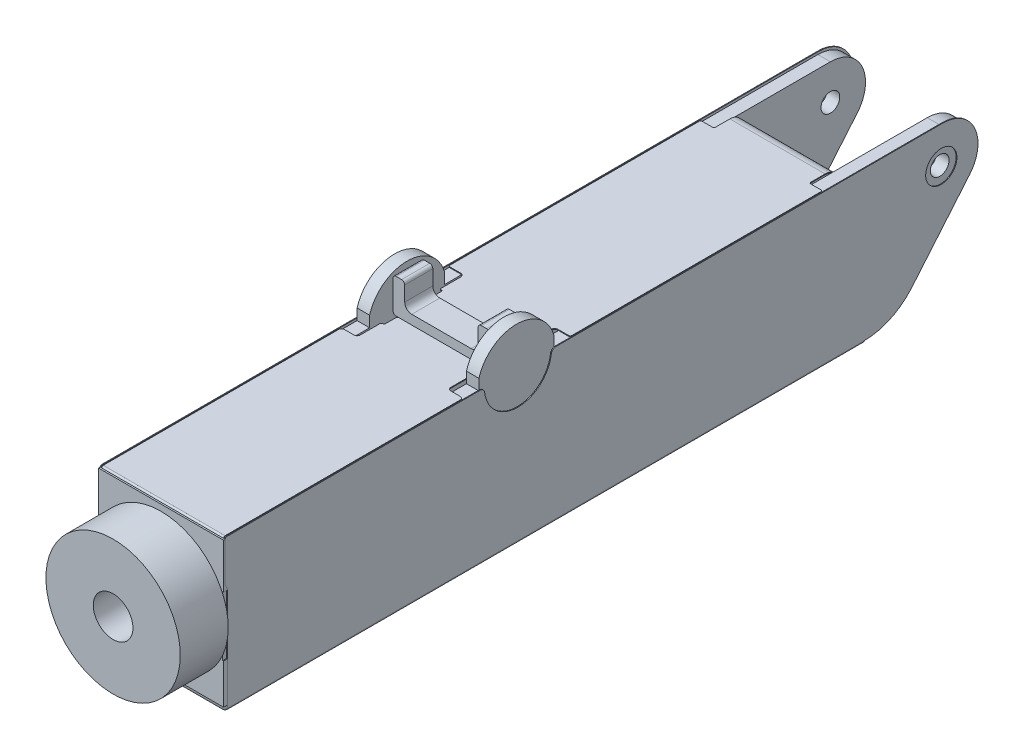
SolidWorks part; units mm, degrees
ref_plane "Ebene vorne" through (0, 0, 0) normal (0, 0, 1) x (1, 0, 0)
ref_plane "Ebene oben" through (0, 0, 0) normal (0, 1, 0) x (1, 0, 0)
ref_plane "Ebene rechts" through (0, 0, 0) normal (1, 0, 0) x (0, 0, -1)
imported_body "P001317-1-solid1"
imported_body "P001316-3-solid1"
imported_body "P001308-1/P001309-1-solid1"
imported_body "P001465-1-solid1"
imported_body "P001536-1-solid1"
imported_body "P001536-1-solid2"
imported_body "P001538-1-solid1"
imported_body "P001537-1-solid1"
imported_body "P003440-1/P001274-1-solid1"
sketch "Skizze3" plane through (0, 0, -150.0769) normal (0, 0, 1) x (1, 0, 0)
  line L0 (-40, -67.7053) -> (-40, -93.2053) construction
  line L1 (40, -134.7038) -> (-40, -134.7038)
  line L2 (40, -134.7038) -> (40, -67.7053)
  line L3 (40, -67.7053) -> (-40, -67.7053)
  line L4 (-40, -134.7038) -> (-40, -67.7053)
  line L5 (-39.5, -67.7053) -> (-40, -67.7053) construction
  line L6 (40, -134.7038) -> (40, -162.2053) construction
  line L7 (-40, -134.7038) -> (40, -134.7038)
  line L8 (-40, -134.7038) -> (-40, -160.338)
  line L9 (-40, -160.338) -> (40, -160.338)
  line L10 (40, -134.7038) -> (40, -160.338)
extrude "Aufsatz-Linear austragen2" add sketch "Skizze3" along normal blind 2.5 separate body contours L4 L1 L2 L3 M7 M6 | L10 L1 L8 L9 M8
